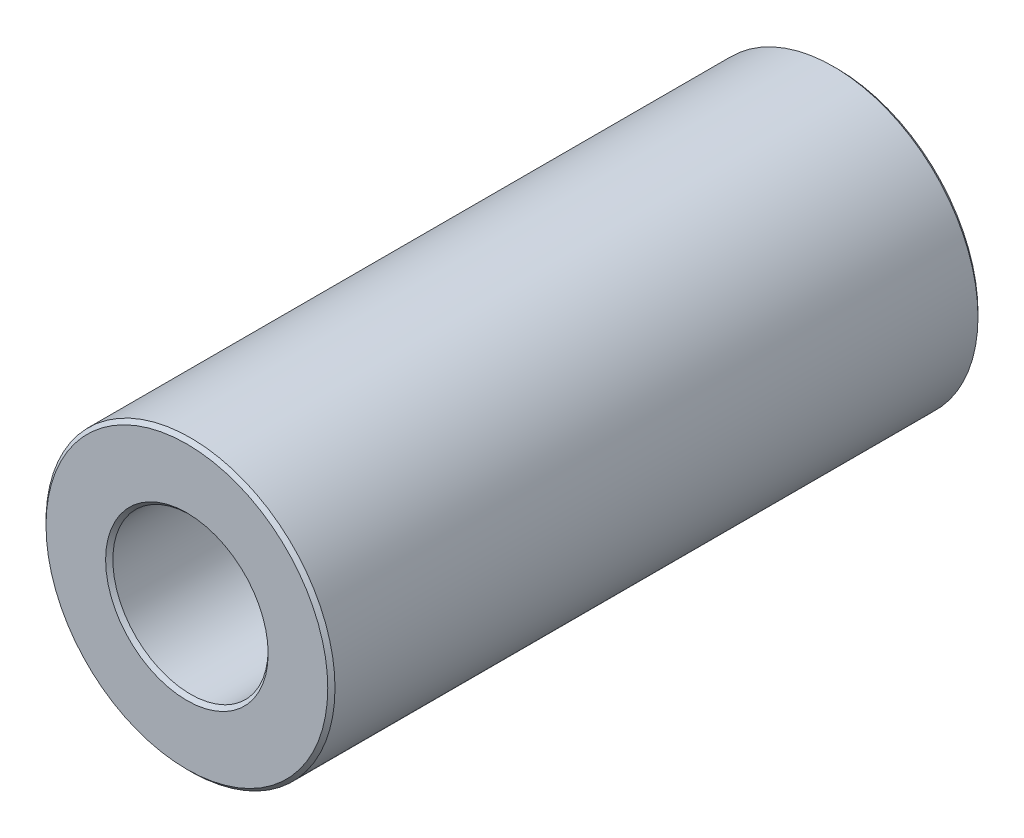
SolidWorks part; units mm, degrees
ref_plane "Front Plane" through (0, 0, 0) normal (0, 0, 1) x (1, 0, 0)
ref_plane "Top Plane" through (0, 0, 0) normal (0, 1, 0) x (1, 0, 0)
ref_plane "Right Plane" through (0, 0, 0) normal (1, 0, 0) x (0, 0, -1)
sketch "Sketch1" plane through (0, 0, 0) normal (0, 0, 1) x (1, 0, 0)
  circle A0 centre (0, 0) radius 4
  circle A1 centre (0, 0) radius 2.15
  dimension "D1" = 8
  dimension "D2" = 4.3
extrude "Boss-Extrude2" add sketch "Sketch1" along normal mid plane 18
chamfer "Chamfer3" distance 0.1 angle 45 4 edges at (4, 0, 9) (4, 0, -9) (2.15, 0, -9) (2.15, 0, 9)
